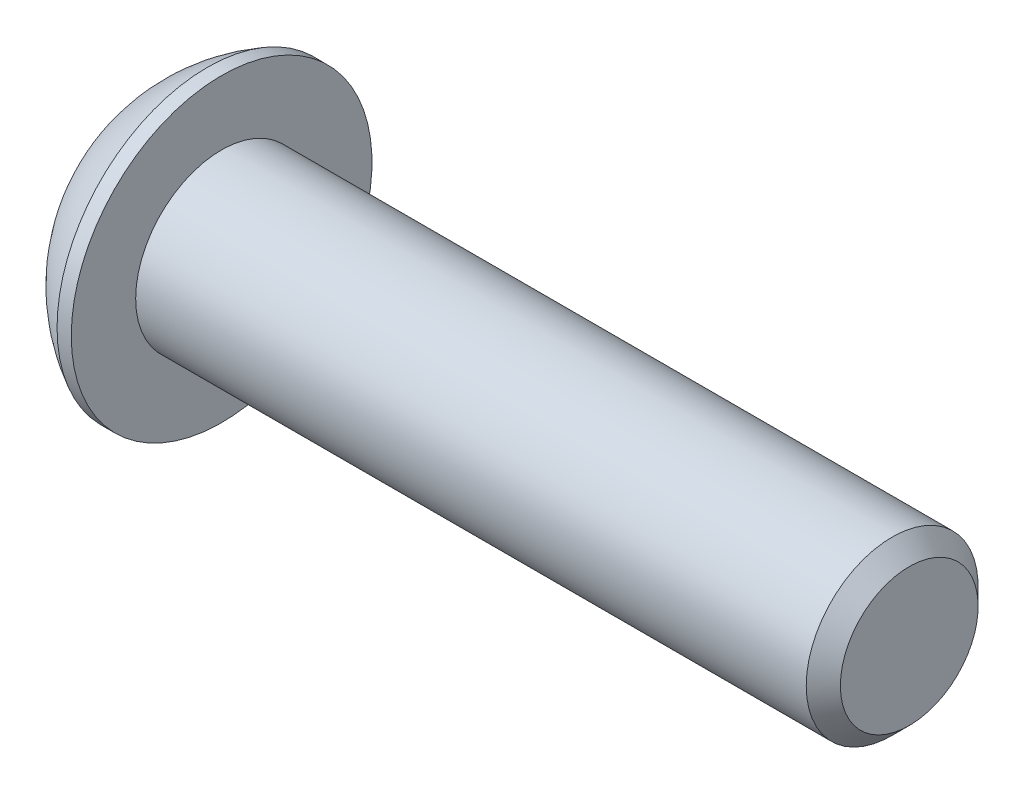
SolidWorks part; units mm, degrees
ref_plane "Plane1" through (0, 0, 0) normal (0, 0, 1) x (1, 0, 0)
ref_plane "Plane2" through (0, 0, 0) normal (0, 1, 0) x (1, 0, 0)
ref_plane "Plane3" through (0, 0, 0) normal (1, 0, 0) x (0, 0, -1)
other "Configuration Table"
sketch "BodySke" plane through (0, 0, 0) normal (0, 0, 1) x (1, 0, 0)
  line L0 (42.9768, 0) -> (42.9768, 3.8163)
  line L1 (42.0306, 4.7625) -> (4.8768, 4.7625)
  line L2 (4.8768, 4.7625) -> (4.8768, 8.3312)
  line L3 (4.8768, 8.3312) -> (4.0894, 8.3312)
  line L4 (0, 0) -> (101.6, 0) construction
  line L5 (4.8768, -8.3312) -> (4.0894, -8.3312) construction
  line L6 (55.6768, -4.7625) -> (4.8768, -4.7625) construction
  line L7 (42.9768, 0) -> (0, 0)
  line L8 (0, 4.1656) -> (0, -4.1656) construction
  line L9 (0, 0) -> (0, 4.1656)
  line L10 (42.9768, 3.8163) -> (42.0306, 4.7625)
  line L11 (42.9768, -3.8163) -> (42.0306, -4.7625) construction
  line L12 (6.4643, 9.525) -> (6.4643, -4.7625) construction
  line L13 (28.575, 9.525) -> (28.575, -4.7625) construction
  arc A1 (0, 4.1656) -> (4.0894, 8.3312) centre (8.4095, 0) cw
revolve "BaseBody" add sketch "BodySke" angle 360 about L4
sketch "Sketch2" plane through (0, 0, 0) normal (0, 0, 1) x (1, 0, 0)
  line L0 (0, 2.7813) -> (3.0988, 2.7813)
  line L1 (3.0988, 2.7813) -> (4.7046, 0)
  line L3 (4.7046, 0) -> (0, 0)
  line L4 (0, 0) -> (0, 2.7813)
  line L5 (0, -2.7813) -> (3.0988, -2.7813) construction
  line L6 (0, 0) -> (47.625, 0) construction
  dimension "D2" = 60
  dimension "PreBroach_depth" = 3.0988
  dimension "PreBroach_dia" = 5.5626
revolve "PreBroach" cut sketch "Sketch2" angle 360 about L6
sketch "Sketch3" plane through (0, 0, 0) normal (1, 0, 0) x (0, 0, -1)
  line L0 (-2.7813, -1.6058) -> (-2.7813, 1.6058)
  line L1 (-2.7813, 1.6058) -> (0, 3.2116)
  line L2 (0, 3.2116) -> (2.7813, 1.6058)
  line L3 (2.7813, 1.6058) -> (2.7813, -1.6058)
  line L4 (2.7813, -1.6058) -> (0, -3.2116)
  line L5 (0, -3.2116) -> (-2.7813, -1.6058)
extrude "Hex" cut sketch "Sketch3" along normal blind 3.0988
sketch "Sketch4" plane through (0, 9.525, 0) normal (1, 0, 0) x (0, 0, -1)
  line L0 (0, -9.525) -> (3.2512, -9.525)
  line L1 (0, -9.525) -> (6.1484, -5.9752) construction
  line L2 (0, -9.525) -> (1.6256, -6.7094)
  line L3 (2.7204, -8.8343) -> (3.1182, -8.6046)
  line L4 (1.9584, -7.5144) -> (2.3562, -7.2848)
  arc A0 (2.7204, -8.8343) -> (1.9584, -7.5144) centre (0, -9.525) ccw
  arc A1 (3.2512, -9.525) -> (3.1182, -8.6046) centre (0, -9.525) ccw
  arc A2 (1.6256, -6.7094) -> (2.3562, -7.2848) centre (0, -9.525) cw
extrude "Spline" [suppressed] cut sketch "Sketch4" along normal blind 3.0988
pattern_circular "CirPattern1" [suppressed] count 6 every 60 about axis through (0, 0, 0) along (1, 0, 0)
sketch "ThdSchSke" plane through (0, 0, 0) normal (0, 0, 1) x (1, 0, 0)
  line L0 (28.575, -3.8163) -> (27.9125, -4.7625)
  line L1 (28.575, -3.8163) -> (29.2375, -4.7625)
  line L2 (29.2375, -4.7625) -> (29.2375, -5.9531)
  line L3 (-3.175, 0) -> (5.1513, 0) construction
  line L5 (29.2375, -5.9531) -> (27.9125, -5.9531)
  line L6 (27.9125, -5.9531) -> (27.9125, -4.7625)
revolve "ThreadSchematic" [suppressed] cut sketch "ThdSchSke" angle 360 about L3
pattern_linear "ThdSchPat" [suppressed]
equation "\"D1@BodySke\" = \"Head_dia@BodySke\" * .5"
equation "\"Thread_minor@ThreadCosmetic\" = \"Minor_dia@BodySke\""
equation "\"D1@Sketch3\" = \"Hex_size@Sketch3\" / 2"
equation "\"D2@Sketch3\" = \"D1@Sketch3\""
equation "\"D3@Sketch3\" = \"Hex_size@Sketch3\""
equation "\"D3@Sketch4\" = \"Spline_p_dim@Sketch4\" / 2"
equation "\"D1@Sketch4\" = \"D2@Sketch4\" / 2"
equation "\"Thread_length@ThreadCosmetic\" = ((sgn( (\"Length@BodySke\" - \"Advance@BodySke\" ) - \"Thread_nom@BodySke\" )-1)*( (\"Length@BodySke\" - \"Advance@BodySke\" ) - \"Thread_nom@BodySke\" ))/-2+ \"Thread_nom@BodySke\""
equation "\"Thread_minor@ThdSchSke\" = \"Minor_dia@BodySke\""
equation "\"Diameter@ThdSchSke\" = \"Diameter@BodySke\""
equation "\"Overcut@ThdSchSke\" = \"Diameter@BodySke\" * 1.25"
equation "\"Start@ThdSchSke\" = \"Head_ht@BodySke\" + \"Length@BodySke\" - \"Thread_length@ThreadCosmetic\"  '---Non-countersunk---"
equation "\"Num_threads@ThdSchPat\" = int( \"Thread_length@ThreadCosmetic\" / \"Advance@BodySke\" + 0.999 )  + 1"
equation "\"Advance@ThdSchPat\" = \"Thread_length@ThreadCosmetic\" /  (\"Num_threads@ThdSchPat\" - 1) 'relax it"
equation "\"Num_threads@ThdSchPat\" = \"Num_threads@ThdSchPat\" - sgn( \"Num_threads@ThdSchPat\" - 1) '---chamfered tips only---"
